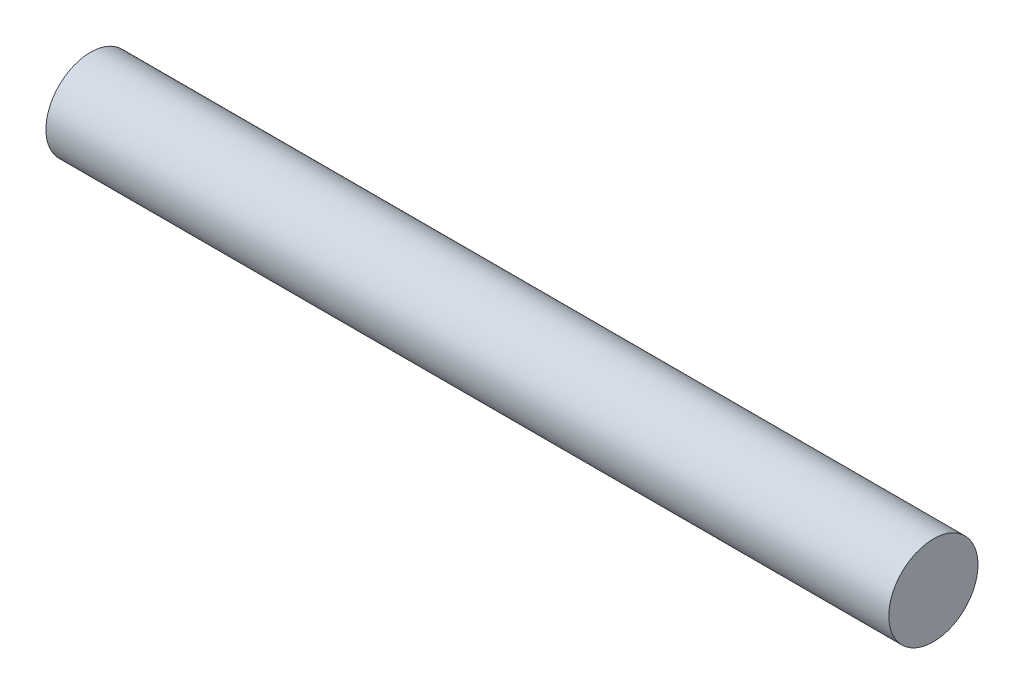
SolidWorks part; units mm, degrees
ref_plane "Front Plane" through (0, 0, 0) normal (0, 0, 1) x (1, 0, 0)
ref_plane "Top Plane" through (0, 0, 0) normal (0, 1, 0) x (1, 0, 0)
ref_plane "Right Plane" through (0, 0, 0) normal (1, 0, 0) x (0, 0, -1)
sketch "Sketch1" plane through (0, 0, 0) normal (1, 0, 0) x (0, 0, -1)
  circle A0 centre (0, 0) radius 1.5875
  dimension "D1" = 3.175
extrude "Boss-Extrude1" add sketch "Sketch1" along normal blind 30
